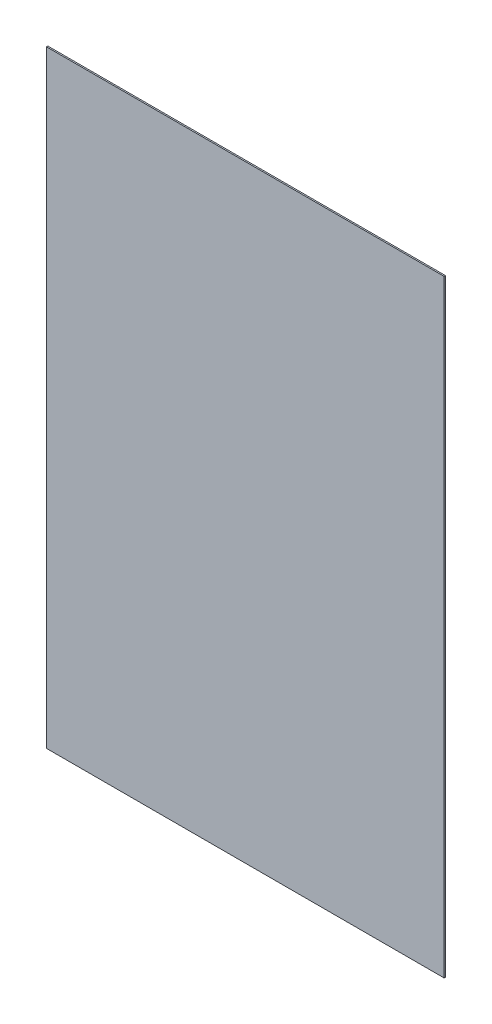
SolidWorks part; units mm, degrees
ref_plane "Front Plane" through (0, 0, 0) normal (0, 0, 1) x (1, 0, 0)
ref_plane "Top Plane" through (0, 0, 0) normal (0, 1, 0) x (1, 0, 0)
ref_plane "Right Plane" through (0, 0, 0) normal (1, 0, 0) x (0, 0, -1)
sketch "Sketch2" plane through (0, 0, 0) normal (0, 0, 1) x (1, 0, 0)
  line L1 (-457.2, -609.6) -> (457.2, -609.6)
  line L2 (-457.2, -609.6) -> (-457.2, 609.6)
  line L3 (-457.2, 609.6) -> (457.2, 609.6)
  line L4 (457.2, -609.6) -> (457.2, 609.6)
  line L5 (-457.2, -609.6) -> (457.2, 609.6) construction
  line L6 (-457.2, 609.6) -> (457.2, -609.6) construction
  point P0 (0, 0)
extrude "Boss-Extrude1" add sketch "Sketch2" along normal mid plane 3.175
sketch "Sketch3" plane through (0, -609.6, 0) normal (0, -1, 0) x (1, 0, 0)
  line L4 (-457.2, -1.5875) -> (457.2, -1.5875)
  line L5 (457.2, -1.5875) -> (457.2, 1.5875)
  line L6 (457.2, 1.5875) -> (-457.2, 1.5875)
  line L7 (-457.2, 1.5875) -> (-457.2, -1.5875)
  line L8 (-457.2, -1.5875) -> (457.2, -1.5875)
  line L9 (457.2, -1.5875) -> (457.2, 1.5875)
  line L10 (457.2, 1.5875) -> (-457.2, 1.5875)
  line L11 (-457.2, 1.5875) -> (-457.2, -1.5875)
  dimension "D1" = 0
extrude "Boss-Extrude2" add sketch "Sketch3" along normal up to surface (177.8 mm away)
equation "\"D1@Sketch2\"=36"
